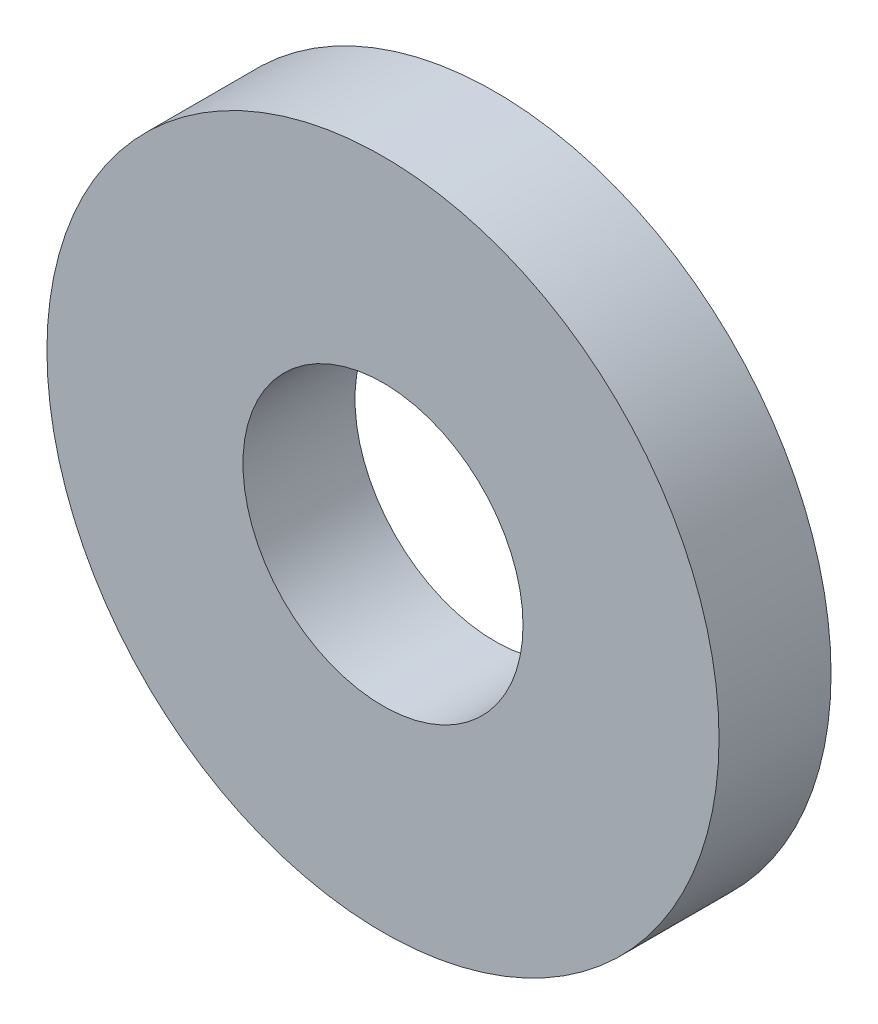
SolidWorks part; units mm, degrees
ref_plane "Alzado" through (0, 0, 0) normal (0, 0, 1) x (1, 0, 0)
ref_plane "Planta" through (0, 0, 0) normal (0, 1, 0) x (1, 0, 0)
ref_plane "Vista lateral" through (0, 0, 0) normal (1, 0, 0) x (0, 0, -1)
sketch3d "Sk_Anillo"
  line L0 (-425.1, 65, -54) -> (-425.1, 65, -50)
sweep "Anillo" add path "Sk_Anillo" parameters "D3"=24
sketch3d "Sk_Taladro"
  line L0 (-425.1, 65, -54) -> (-425.1, 65, -50)
sweep "Taladro" cut path "Sk_Taladro" parameters "D3"=10
